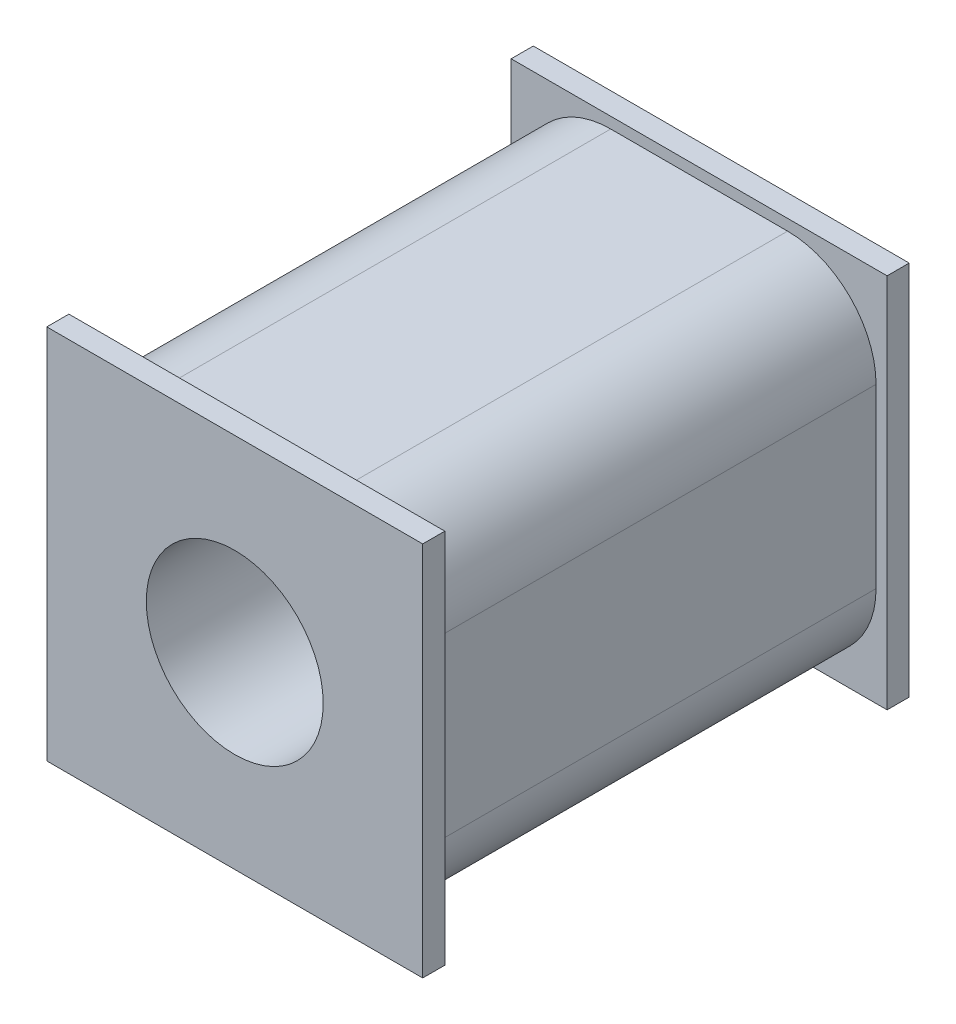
SolidWorks part; units mm, degrees
ref_plane "Plan1" through (0, 0, 0) normal (0, 0, 1) x (1, 0, 0)
ref_plane "Plan2" through (0, 0, 0) normal (0, 1, 0) x (1, 0, 0)
ref_plane "Plan3" through (0, 0, 0) normal (1, 0, 0) x (0, 0, -1)
sketch "Esquisse1" plane through (0, 0, 0) normal (0, 0, 1) x (1, 0, 0)
  line L1 (-4, 4) -> (4, 4)
  line L2 (-4, 4) -> (-4, -4)
  line L3 (-4, -4) -> (4, -4)
  line L4 (4, 4) -> (4, -4)
  circle A0 centre (0, 0) radius 2
  dimension "D1" = 4
  dimension "D2" = 8
  dimension "D3" = 4
  dimension "D4" = 8
  dimension "D5" = 4
extrude "Base-Extrusion" add sketch "Esquisse1" along normal blind 10
fillet "Congé1" radius 2
sketch "Esquisse2" plane through (0, 0, 10) normal (0, 0, 1) x (1, 0, 0)
  line L1 (-4.25, 4.25) -> (4.25, 4.25)
  line L2 (-4.25, 4.25) -> (-4.25, -4.25)
  line L3 (-4.25, -4.25) -> (4.25, -4.25)
  line L4 (4.25, 4.25) -> (4.25, -4.25)
  dimension "D1" = 8.5
  dimension "D2" = 8.5
  dimension "D3" = 4.25
  dimension "D4" = 4.25
extrude "Boss.-Extru.1" add sketch "Esquisse2" along normal blind 0.5
ref_plane "Plan4" through (0, 0, 5) normal (0, 0, 1) x (1, 0, 0)
mirror "Symétrie1" about plane through (0, 0, 5) normal (0, 0, 1)
sketch "Esquisse3" plane through (0, 0, -0.5) normal (0, 0, -1) x (-1, 0, 0)
  circle A0 centre (0, 0) radius 2 construction
  circle A1 centre (0, 0) radius 2
extrude "Enlèv. mat.-Extru.1" cut sketch "Esquisse3" against normal through all
